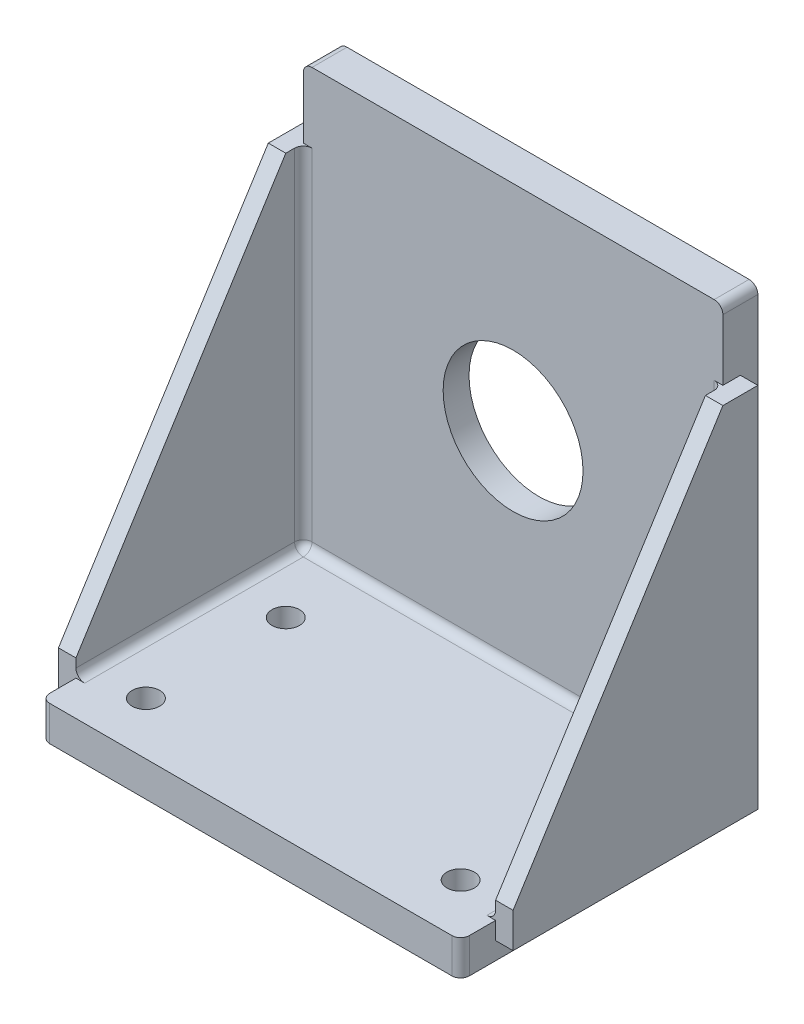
SolidWorks part; units mm, degrees
ref_plane "front" through (0, 0, 0) normal (0, 0, 1) x (1, 0, 0)
ref_plane "top" through (0, 0, 0) normal (0, 1, 0) x (1, 0, 0)
ref_plane "side" through (0, 0, 0) normal (1, 0, 0) x (0, 0, -1)
sketch "Sketch1" plane through (0, 0, 0) normal (0, 0, 1) x (1, 0, 0)
  line L0 (0, 0) -> (0, 77.7875) construction
  line L1 (-58.7375, 0) -> (0, 0) construction
  line L2 (76.2, -74.6125) -> (76.2, 77.7875)
  line L3 (76.2, 77.7875) -> (-76.2, 77.7875)
  line L4 (-76.2, 77.7875) -> (-76.2, -74.6125)
  line L5 (76.2, -74.6125) -> (-76.2, -74.6125)
  line L6 (-58.7375, 58.7375) -> (58.7375, 58.7375) construction
  line L7 (-58.7375, -58.7375) -> (58.7375, -58.7375) construction
  line L8 (-58.7375, -58.7375) -> (-58.7375, 58.7375) construction
  line L9 (58.7375, -58.7375) -> (58.7375, 58.7375) construction
  circle A4 centre (58.7375, 58.7375) radius 4.7625
  circle A6 centre (-58.7375, 58.7375) radius 4.7625
  circle A7 centre (58.7375, -58.7375) radius 4.7625
  circle A8 centre (-58.7375, -58.7375) radius 4.7625
  dimension "D1" = 117.475
  dimension "D3" = 9.525
  dimension "D2" = 152.4
  dimension "D4" = 117.475
  dimension "D5" = 19.05
  dimension "D6" = 152.4
extrude "Base-Extrude" add sketch "Sketch1" along normal blind 12.7 contours L3 L4 L5 L2
sketch "Sketch2" plane through (76.2, 0, 0) normal (1, 0, 0) x (0, 0, -1)
  line L0 (-6.35, -74.6125) -> (-107.95, -74.6125)
  line L1 (-6.35, -74.6125) -> (-6.35, -87.3125)
  line L2 (-107.95, -87.3125) -> (-6.35, -87.3125)
  line L3 (-107.95, -87.3125) -> (-107.95, -74.6125)
  line L4 (-12.7, -74.6125) -> (0, -74.6125) construction
  dimension "D1" = 101.6
  dimension "D2" = 12.7
extrude "Boss-Extrude1" add sketch "Sketch2" against normal up to vertex (152.4 mm away)
sketch "Sketch3" plane through (76.2, 0, 0) normal (1, 0, 0) x (0, 0, -1)
  line L0 (-6.35, -80.9625) -> (-6.35, 52.3875)
  line L1 (-6.35, 52.3875) -> (-19.05, 52.3875)
  line L2 (-19.05, 52.3875) -> (-95.25, -68.2625)
  line L3 (-95.25, -68.2625) -> (-95.25, -80.9625)
  line L4 (-6.35, -80.9625) -> (-95.25, -80.9625)
  line L5 (-6.35, -74.6125) -> (-6.35, -87.3125) construction
  line L6 (-12.7, 77.7875) -> (0, 77.7875) construction
  line L7 (-107.95, -87.3125) -> (-107.95, -74.6125) construction
  dimension "D1" = 12.7
  dimension "D2" = 12.7
  dimension "D3" = 25.4
  dimension "D4" = 12.7
extrude "Boss-Extrude2" add sketch "Sketch3" along normal blind 6.35
mirror "Mirror1" about plane through (0, 0, 0) normal (1, 0, 0) of "Boss-Extrude2"
sketch "Sketch4" plane through (0, -74.6125, 0) normal (0, 1, 0) x (-1, 0, 0)
  line L0 (76.2, 95.25) -> (76.2, 107.95) construction
  line L1 (76.2, 107.95) -> (-76.2, 107.95) construction
  circle A0 centre (57.15, 88.9) radius 6.7437 construction
  dimension "D1" = 13.4874
  dimension "D2" = 19.05
  dimension "D3" = 19.05
hole_wizard "Perçage1" positions "Esquisse1" profile "Esquisse2" legacy
sketch "Esquisse1" plane through (0, -74.6125, 0) normal (0, 1, 0) x (1, 0, 0)
  point P0 (-57.15, -88.9)
sketch "Esquisse2" plane through (-57.15, -74.6125, 88.9) normal (1, 0, 0) x (0, 0, 1)
  line L0 (0, 0) -> (0, 12.7)
  line L1 (0, 12.7) -> (5, 12.7)
  line L2 (5, 12.7) -> (5, 0)
  line L3 (5, 0) -> (0, 0)
  line L4 (0, 110) -> (0, -10) construction
  dimension "Diamètre" = 10
  dimension "Profondeur" = 12.7
pattern_linear "LPattern1" count 2 spacing 114.3 along (1, 0, 0) count 2 spacing 50.8 along (0, 0, -1) of "Perçage1"
sketch "Sketch5" plane through (0, 0, 0) normal (0, 0, -1) x (-1, 0, 0)
  circle A0 centre (0, 0) radius 63.5635
  dimension "D1" = 127.127
extrude "pilot bore" cut sketch "Sketch5" against normal blind 3.302
sketch "Sketch6" plane through (0, 0, 3.302) normal (0, 0, -1) x (-1, 0, 0)
  circle A0 centre (0, 0) radius 25.4
  dimension "D1" = 50.8
extrude "Cut-Extrude3" cut sketch "Sketch6" against normal through all
fillet "Fillet1" radius 3.175 1 edges at (0, -74.6125, 12.7)
fillet "Fillet2" radius 3.175 6 edges at (76.2, -80.9625, 107.95) (-76.2, -80.9625, 107.95) (-76.2, 77.7875, 6.35) (76.2, 77.7875, 6.35) (-76.2, -73.6826, 13.6299) (76.2, -73.6826, 13.6299)
